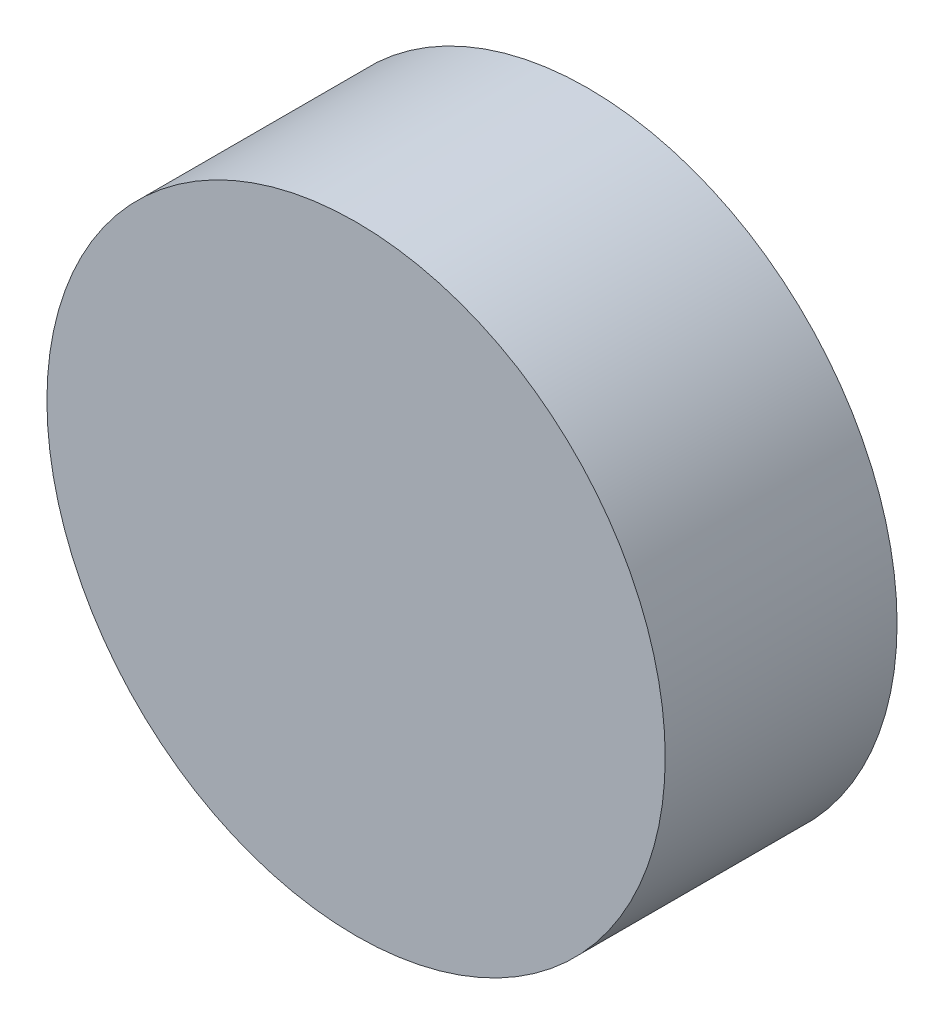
SolidWorks part; units mm, degrees
ref_plane "Front Plane" through (0, 0, 0) normal (0, 0, 1) x (1, 0, 0)
ref_plane "Top Plane" through (0, 0, 0) normal (0, 1, 0) x (1, 0, 0)
ref_plane "Right Plane" through (0, 0, 0) normal (1, 0, 0) x (0, 0, -1)
imported_body "LiDar.step<1>"
sketch "Sketch1" plane through (0, 0, 0) normal (0, 0, -1) x (-1, 0, 0)
  line L0 (0, 101.6) -> (0, -101.6) construction
  line L1 (101.6, 0) -> (-101.6, 0) construction
  circle A0 centre (0, 0) radius 101.6 construction
  circle A1 centre (0, 0) radius 5.08
extrude "Cut-Extrude1" cut sketch "Sketch1" against normal blind 5.08
